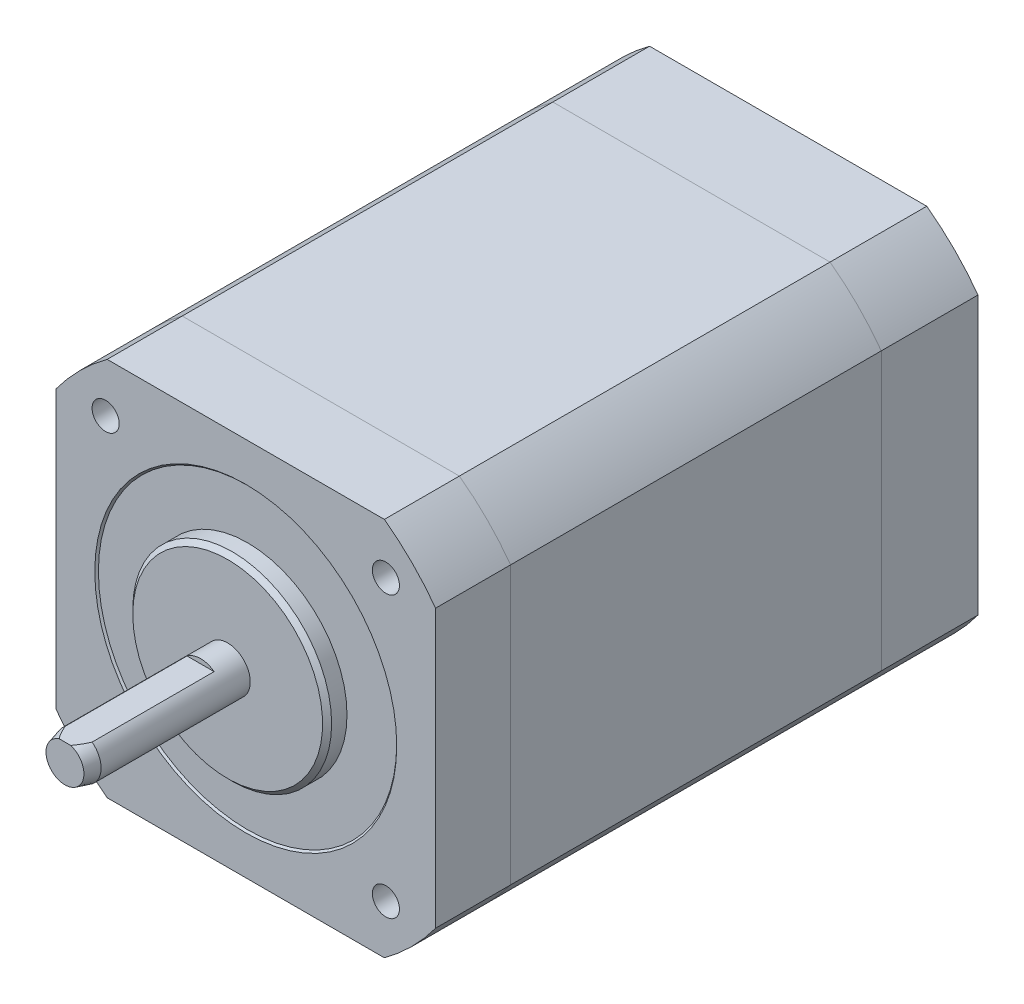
SolidWorks part; units mm, degrees
ref_plane "正面" through (0, 0, 0) normal (0, 0, 1) x (1, 0, 0)
ref_plane "平面" through (0, 0, 0) normal (0, 1, 0) x (1, 0, 0)
ref_plane "右側面" through (0, 0, 0) normal (1, 0, 0) x (0, 0, -1)
sketch "ｽｹｯﾁ1" plane through (0, 0, 0) normal (0, 0, 1) x (1, 0, 0)
  circle A0 centre (0, 0) radius 2.5
  dimension "D1" = 5
extrude "押し出し1" add sketch "ｽｹｯﾁ1" along normal blind 18
sketch "ｽｹｯﾁ2" plane through (0, 0, 0) normal (0, 0, -1) x (-1, 0, 0)
  circle A0 centre (0, 0) radius 11
  dimension "D1" = 22
extrude "押し出し2" add sketch "ｽｹｯﾁ2" along normal blind 2
sketch "ｽｹｯﾁ3" plane through (0, 0, -2) normal (0, 0, -1) x (-1, 0, 0)
  line L1 (-21, 21) -> (21, 21)
  line L2 (-21, 21) -> (-21, -21)
  line L3 (-21, -21) -> (21, -21)
  line L4 (21, 21) -> (21, -21)
  line L5 (-21, 21) -> (21, -21) construction
  line L6 (-21, -21) -> (21, 21) construction
  point P0 (0, 0)
  point P6 (0, 0)
  dimension "D1" = 42
  dimension "D2" = 42
extrude "押し出し3" add sketch "ｽｹｯﾁ3" along normal blind 8.3
sketch "Sketch8" plane through (0, 0, -2) normal (0, 0, 1) x (1, 0, 0)
  circle A0 centre (0, 0) radius 26
  dimension "D1" = 52
extrude "Extrude8" cut sketch "Sketch8" against normal blind 34 flip side to cut
sketch "Sketch9" plane through (0, 0, -10.3) normal (0, 0, -1) x (-1, 0, 0)
  line L4 (-21, 15.3297) -> (-21, -15.3297) construction
  line L5 (-15.3297, -21) -> (15.3297, -21) construction
  line L6 (21, -15.3297) -> (21, 15.3297) construction
  line L7 (15.3297, 21) -> (-15.3297, 21) construction
  line L8 (-21, 15.3297) -> (-21, -15.3297)
  line L9 (-15.3297, -21) -> (15.3297, -21)
  line L10 (21, -15.3297) -> (21, 15.3297)
  line L11 (15.3297, 21) -> (-15.3297, 21)
  arc A1 (21, 15.3297) -> (15.3297, 21) centre (0, 0) ccw
  arc A2 (-15.3297, 21) -> (-21, 15.3297) centre (0, 0) ccw
  arc A3 (-21, -15.3297) -> (-15.3297, -21) centre (0, 0) ccw
  arc A4 (15.3297, -21) -> (21, -15.3297) centre (0, 0) ccw
  dimension "D1" = 52
extrude "Extrude9" add sketch "Sketch9" along normal blind 41 separate body
sketch "Sketch14" plane through (0, 0, -2) normal (0, 0, 1) x (1, 0, 0)
  line L5 (15.5, -15.5) -> (-15.5, 15.5) construction
  line L6 (15.5, 15.5) -> (-15.5, -15.5) construction
  circle A0 centre (-15.5, 15.5) radius 1.5
  circle A1 centre (15.5, 15.5) radius 1.5
  circle A2 centre (15.5, -15.5) radius 1.5
  circle A3 centre (-15.5, -15.5) radius 1.5
  point P0 (0, 0)
  dimension "D3" = 3
  dimension "D4" = 3
  dimension "D5" = 3
  dimension "D6" = 3
  dimension "D1" = 31
  dimension "D2" = 31
  dimension "D7" = 15.5
  dimension "D8" = 15.5
  dimension "D9" = 31
  dimension "D10" = 31
extrude "Extrude13" cut sketch "Sketch14" against normal blind 4.5
sketch "Sketch11" plane through (0, 0, -51.3) normal (0, 0, -1) x (-1, 0, 0)
  line L15 (-15.3297, -21) -> (15.3297, -21)
  line L16 (21, -15.3297) -> (21, 15.3297)
  line L17 (15.3297, 21) -> (-15.3297, 21)
  line L18 (-21, 15.3297) -> (-21, -15.3297)
  line L19 (-15.3297, -21) -> (15.3297, -21)
  line L20 (21, -15.3297) -> (21, 15.3297)
  line L21 (15.3297, 21) -> (-15.3297, 21)
  line L23 (-21, 15.3297) -> (-21, -15.3297)
  arc A8 (-21, -15.3297) -> (-15.3297, -21) centre (0, 0) ccw
  arc A9 (15.3297, -21) -> (21, -15.3297) centre (0, 0) ccw
  arc A10 (21, 15.3297) -> (15.3297, 21) centre (0, 0) ccw
  arc A11 (-15.3297, 21) -> (-21, 15.3297) centre (0, 0) ccw
  arc A12 (-21, -15.3297) -> (-15.3297, -21) centre (0, 0) ccw
  arc A13 (15.3297, -21) -> (21, -15.3297) centre (0, 0) ccw
  arc A14 (21, 15.3297) -> (15.3297, 21) centre (0, 0) ccw
  arc A15 (-15.3297, 21) -> (-21, 15.3297) centre (0, 0) ccw
  dimension "D1" = 0
extrude "Extrude11" add sketch "Sketch11" along normal blind 10.7 separate body
chamfer "Chamfer5" distance 1.5 angle 15 1 edges at (2.5, 0, 18)
sketch "Sketch2" plane through (0, 0, 18) normal (0, 0, 1) x (1, 0, 0)
  line L1 (-4.7278, 5.1185) -> (3.4221, 5.1185)
  line L2 (-4.7278, 5.1185) -> (-4.7278, 2)
  line L3 (-4.7278, 2) -> (3.4221, 2)
  line L4 (3.4221, 5.1185) -> (3.4221, 2)
  dimension "D1" = 2
extrude "Extrude2" cut sketch "Sketch2" against normal blind 15
sketch "Sketch6" plane through (0, 0, -2) normal (0, 0, 1) x (1, 0, 0)
  circle A0 centre (0, 0) radius 16.5
  circle A1 centre (0, 0) radius 11 construction
  circle A2 centre (0, 0) radius 11
  dimension "D2" = 33
extrude "Extrude6" cut sketch "Sketch6" against normal blind 0.2
chamfer "Chamfer2" distance 0.5 angle 45 1 edges at (-11, 0, 0)
chamfer "Chamfer7" distance 0.2 angle 45 1 edges at (16.5, 0, -2)
sketch "Sketch13" plane through (0, -21, 0) normal (0, -1, 0) x (1, 0, 0)
  line L1 (-8.4, -51.8) -> (8.4, -51.8)
  line L2 (-8.4, -51.8) -> (-8.4, -62)
  line L3 (-8.4, -62) -> (8.4, -62)
  line L4 (8.4, -51.8) -> (8.4, -62)
  line L6 (15.3297, -62) -> (-15.3297, -62) construction
  point P4 (8.4, -62)
  point P6 (0, 0)
  dimension "D1" = 10.2
  dimension "D2" = 16.8
  dimension "D3" = 8.4
extrude "Extrude12" add sketch "Sketch13" along normal blind 4.6 separate body
